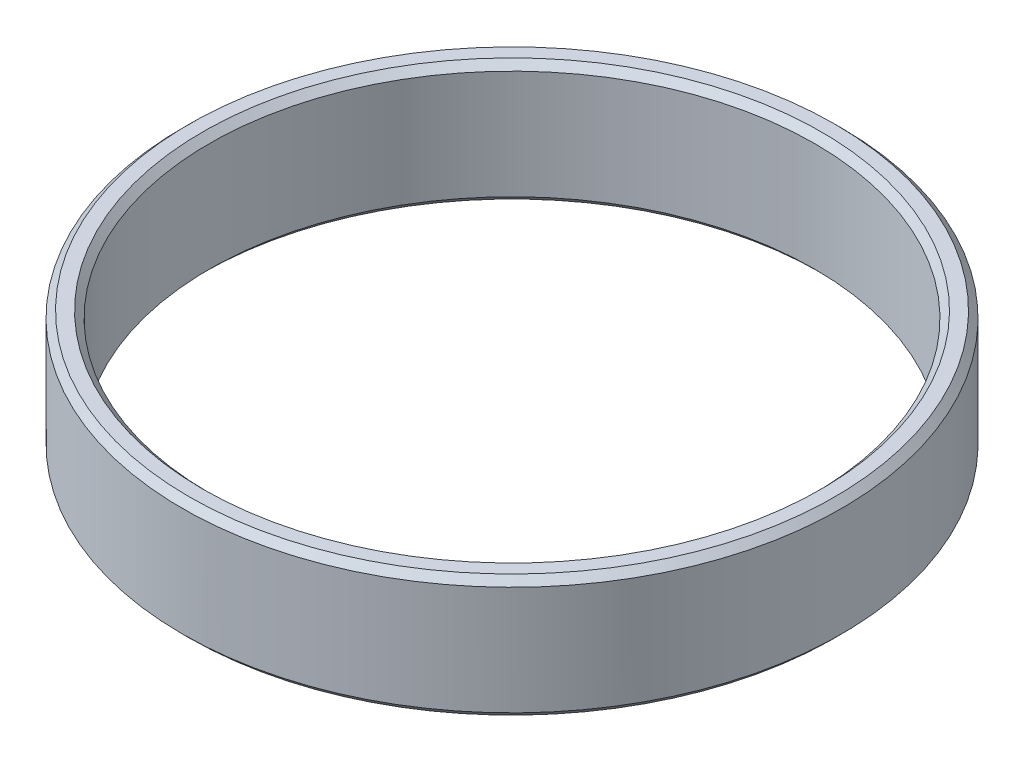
SolidWorks part; units mm, degrees
ref_plane "Front Plane" through (0, 0, 0) normal (0, 0, 1) x (1, 0, 0)
ref_plane "Top Plane" through (0, 0, 0) normal (0, 1, 0) x (1, 0, 0)
ref_plane "Right Plane" through (0, 0, 0) normal (1, 0, 0) x (0, 0, -1)
sketch "Sketch1" plane through (0, 0, 0) normal (0, 1, 0) x (1, 0, 0)
  circle A0 centre (0, 0) radius 71.3791
  circle A1 centre (0, 0) radius 77.7291
  dimension "D1" = 155.4582
  dimension "D2" = 6.35
extrude "Boss-Extrude1" add sketch "Sketch1" along normal blind 28.829
chamfer "Chamfer1" distance 1.5875 angle 45 4 edges at (0, 0, 77.7291) (0, 0, 71.3791) (0, 28.829, 77.7291) (0, 28.829, 71.3791)
